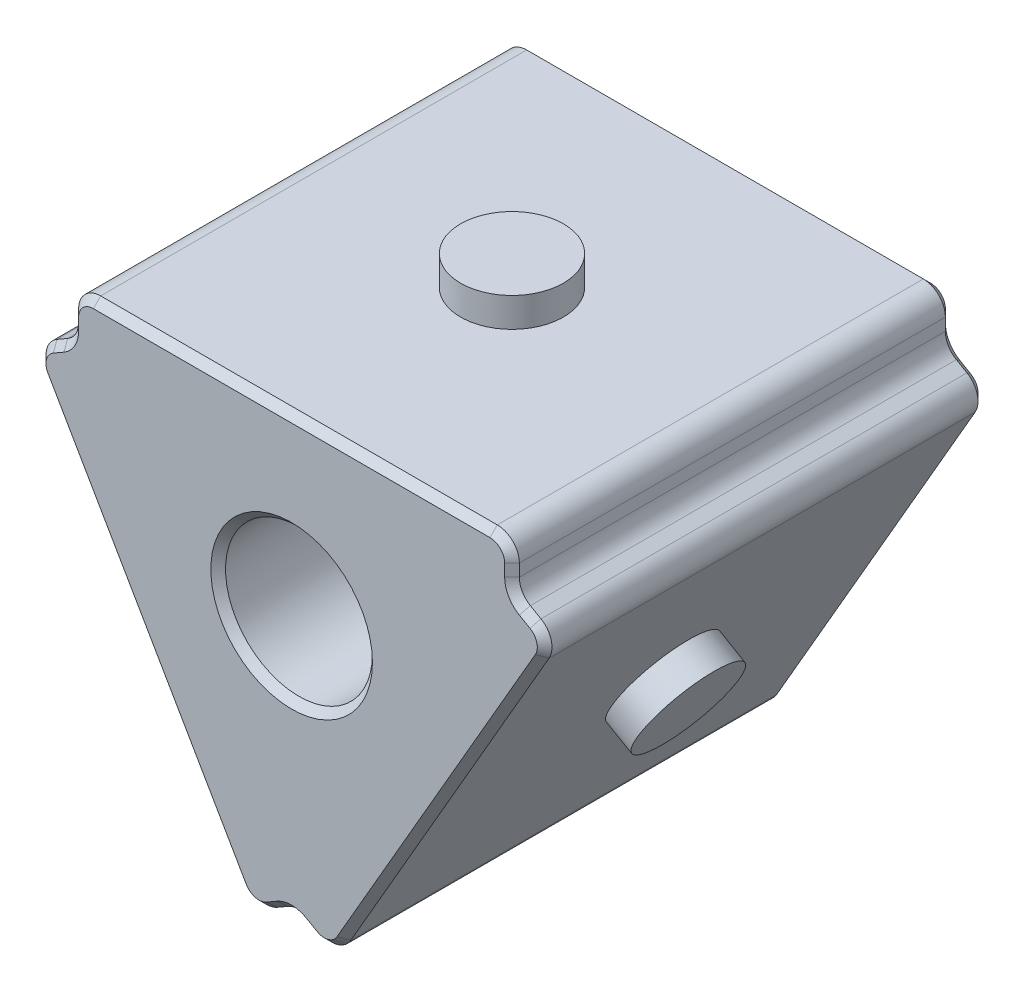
SolidWorks part; units mm, degrees
ref_plane "Płaszczyzna przednia" through (0, 0, 0) normal (0, 0, 1) x (1, 0, 0)
ref_plane "Płaszczyzna górna" through (0, 0, 0) normal (0, 1, 0) x (1, 0, 0)
ref_plane "Płaszczyzna prawa" through (0, 0, 0) normal (1, 0, 0) x (0, 0, -1)
sketch "Szkic1" plane through (0, 0, 0) normal (0, 0, 1) x (1, 0, 0)
  line L0 (0.7728, 19.536) -> (-38.1984, -2.964)
  line L1 (-38.1984, -2.964) -> (-35.6984, -7.2941)
  line L2 (-35.6984, -7.2941) -> (37.2439, -7.2941)
  line L3 (37.2439, -7.2941) -> (39.7439, -2.964)
  line L4 (39.7439, -2.964) -> (0.7728, 19.536)
  line L5 (15.7728, 45.5168) -> (54.7439, 23.0168)
  line L6 (54.7439, 23.0168) -> (57.2439, 27.3469)
  line L7 (57.2439, 27.3469) -> (20.7728, 90.5168)
  line L8 (20.7728, 90.5168) -> (15.7728, 90.5168)
  line L9 (15.7728, 90.5168) -> (15.7728, 45.5168)
  line L10 (-14.2272, 45.5168) -> (-14.2272, 90.5168)
  line L11 (-14.2272, 90.5168) -> (-19.2272, 90.5168)
  line L12 (-19.2272, 90.5168) -> (-55.6984, 27.3469)
  line L13 (-55.6984, 27.3469) -> (-53.1984, 23.0168)
  line L14 (-53.1984, 23.0168) -> (-14.2272, 45.5168)
  line L15 (13.594, 35.3432) -> (17.544, 42.1848)
  line L16 (-15.9984, 42.1848) -> (-12.0484, 35.3432)
  line L17 (-4.3272, 48.7167) -> (-12.2272, 48.7167)
sketch "Szkic2" plane through (0, 0, 0) normal (0, 0, 1) x (1, 0, 0)
  line L0 (-53.1984, 23.0168) -> (-14.2272, 45.5168) construction
  line L1 (-15.9984, 42.1848) -> (-12.0484, 35.3432) construction
  line L2 (0.7728, 19.536) -> (-38.1984, -2.964) construction
  line L3 (39.7439, -2.964) -> (0.7728, 19.536) construction
  line L4 (15.7728, 45.5168) -> (54.7439, 23.0168) construction
  line L5 (13.594, 35.3432) -> (17.544, 42.1848) construction
  line L6 (15.7728, 90.5168) -> (15.7728, 45.5168) construction
  line L7 (-14.2272, 45.5168) -> (-14.2272, 90.5168) construction
  line L8 (-4.3272, 48.7167) -> (-12.2272, 48.7167) construction
  line L9 (-16.9984, 43.9168) -> (-14.2272, 45.5168)
  line L10 (-16.9984, 43.9168) -> (-1.9984, 17.9361)
  line L11 (0.7728, 19.536) -> (-1.9984, 17.9361)
  line L12 (3.544, 17.9361) -> (0.7728, 19.536)
  line L13 (15.7728, 45.5168) -> (18.544, 43.9168)
  line L14 (3.544, 17.9361) -> (18.544, 43.9168)
  line L15 (15.7728, 48.7167) -> (15.7728, 45.5168)
  line L16 (-14.2272, 45.5168) -> (-14.2272, 48.7167)
  line L17 (15.7728, 48.7167) -> (-14.2272, 48.7167)
  line L18 (-9.4984, 30.9265) -> (15.7728, 45.5168) construction
  line L19 (0.7728, 48.7167) -> (0.7728, 19.536) construction
  circle A0 centre (0.7728, 36.8565) radius 5
  point P7 (0.7728, 36.8565)
  dimension "D1" = 10
extrude "Dodanie-wyciągnięcie1" add sketch "Szkic2" along normal blind 30
sketch "Szkic3" plane through (0, 48.7167, 0) normal (0, 1, 0) x (1, 0, 0)
  line L0 (-14.2272, 0) -> (15.7728, -30) construction
  circle A0 centre (0.7728, -15) radius 3.5
  dimension "D1" = 7
fillet "Zaokrąglenie1" radius 1.5 9 edges at (15.7728, 45.5168, 15) (0.7728, 19.536, 15) (-14.2272, 45.5168, 15) (-14.2272, 48.7167, 15) (-16.9984, 43.9168, 15) (-1.9984, 17.9361, 15) (3.544, 17.9361, 15) (18.544, 43.9168, 15) (15.7728, 48.7167, 15)
chamfer "Sfazowanie1" distance 0.5 angle 45 38 edges at (5.7728, 36.8565, 0) (-14.4282, 45.6328, 0) (-15.3383, 44.8753, 0) (-16.3982, 43.756, 0) (-9.4984, 30.9265, 0) (-1.8376, 18.5362, 0) (-0.3383, 18.8945, 0) (0.7728, 19.304, 0) (1.8839, 18.8945, 0) (3.3832, 18.5362, 0) (11.044, 30.9265, 0) (17.9438, 43.756, 0) (16.8839, 44.8753, 0) (15.9738, 45.6328, 0) (15.7728, 46.7997, 0) (15.3335, 48.2773, 0) (0.7728, 48.7167, 0) (-13.7879, 48.2773, 0) (-14.2272, 46.7997, 0) (5.7728, 36.8565, 30) (15.3335, 48.2773, 30) (15.7728, 46.7997, 30) (15.9738, 45.6328, 30) (16.8839, 44.8753, 30) (17.9438, 43.756, 30) (11.044, 30.9265, 30) (3.3832, 18.5362, 30) (1.8839, 18.8945, 30) (0.7728, 19.304, 30) (-0.3383, 18.8945, 30) (-1.8376, 18.5362, 30) (-9.4984, 30.9265, 30) (-16.3982, 43.756, 30) (-15.3383, 44.8753, 30) (-14.4282, 45.6328, 30) (-14.2272, 46.7997, 30) (-13.7879, 48.2773, 30) (0.7728, 48.7167, 30)
extrude "Dodanie-wyciągnięcie2" add sketch "Szkic3" along normal blind 2
pattern_circular "Szyk kołowy1" count 3 over 360 about axis through (0.7728, 36.8565, 0) along (0, 0, 1) of "Dodanie-wyciągnięcie2"
